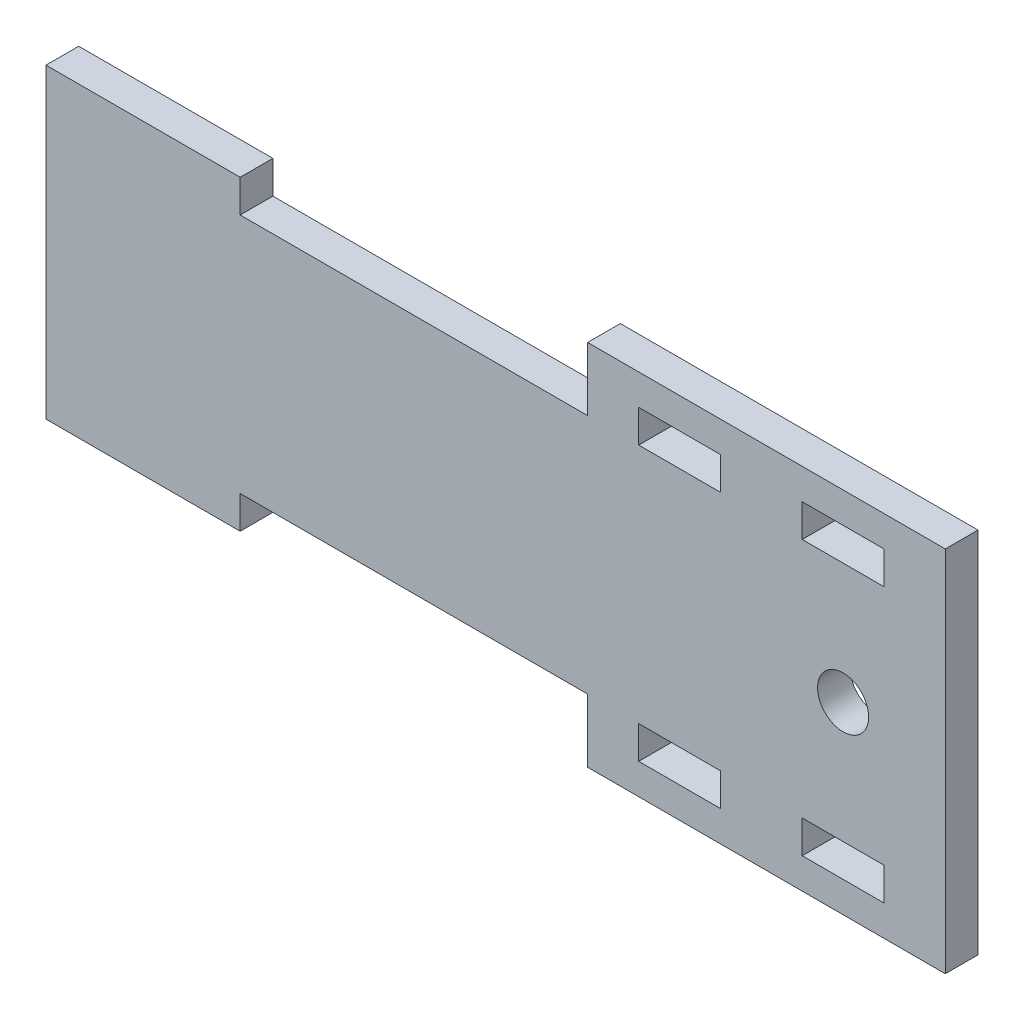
SolidWorks part; units mm, degrees
ref_plane "Plan de face" through (0, 0, 0) normal (0, 0, 1) x (1, 0, 0)
ref_plane "Plan de dessus" through (0, 0, 0) normal (0, 1, 0) x (1, 0, 0)
ref_plane "Plan de droite" through (0, 0, 0) normal (1, 0, 0) x (0, 0, -1)
sketch "Esquisse1" plane through (0, 0, 0) normal (0, 0, 1) x (1, 0, 0)
  line L0 (0, 0) -> (-42.1244, 0) construction
  line L1 (-25, 18) -> (10, 18)
  line L2 (-25, 18) -> (-25, 12)
  line L3 (-25, -18) -> (10, -18)
  line L4 (10, 18) -> (10, -18)
  line L5 (4, -15) -> (-4, -15)
  line L6 (4, -15) -> (4, -11.8)
  line L7 (4, -11.8) -> (-4, -11.8)
  line L8 (-4, -15) -> (-4, -11.8)
  line L9 (-12, -11.8) -> (-20, -11.8)
  line L10 (-12, -11.8) -> (-12, -15)
  line L11 (-12, -15) -> (-20, -15)
  line L12 (-20, -11.8) -> (-20, -15)
  line L13 (4, 15) -> (-4, 15)
  line L14 (4, 15) -> (4, 11.8)
  line L15 (4, 11.8) -> (-4, 11.8)
  line L16 (-4, 15) -> (-4, 11.8)
  line L17 (-12, 15) -> (-20, 15)
  line L18 (-12, 11.8) -> (-12, 15)
  line L19 (-12, 11.8) -> (-20, 11.8)
  line L20 (-20, 11.8) -> (-20, 15)
  line L22 (-36.9589, 11.8) -> (-27.9301, 11.8) construction
  line L23 (-58.9971, 11.8) -> (-58.9971, 15)
  line L24 (-36.9589, 15) -> (-27.9301, 15) construction
  line L25 (-58.9971, 15) -> (-77.9971, 15)
  line L26 (-77.9971, 15) -> (-77.9971, 11.8)
  line L27 (-77.9971, 11.8) -> (-77.9971, -15)
  line L28 (-36.9589, -15) -> (-27.9301, -15) construction
  line L29 (-77.9971, -15) -> (-58.9971, -15)
  line L30 (-58.9971, -15) -> (-58.9971, -11.8)
  line L31 (-36.9589, -11.8) -> (-27.9301, -11.8) construction
  line L33 (-25, -12) -> (-25, -18)
  line L34 (-58.9971, 11.8) -> (-25.0044, 11.8)
  line L35 (-25.0044, 11.8) -> (-25, 12)
  line L36 (-58.9971, -11.8) -> (-25.0044, -11.8)
  line L37 (-25.0044, -11.8) -> (-25, -12)
  circle A0 centre (0, 0) radius 2.5
  point P15 (-12, -13.4)
  dimension "D1" = 5
  dimension "D2" = 36
  dimension "D3" = 18
  dimension "D4" = 10
  dimension "D5" = 35
  dimension "D6" = 3.2
  dimension "D8" = 3
  dimension "D9" = 8
  dimension "D10" = 8
  dimension "D11" = 5
  dimension "D12" = 19
extrude "Boss.-Extru.1" add sketch "Esquisse1" along normal blind 3.2
